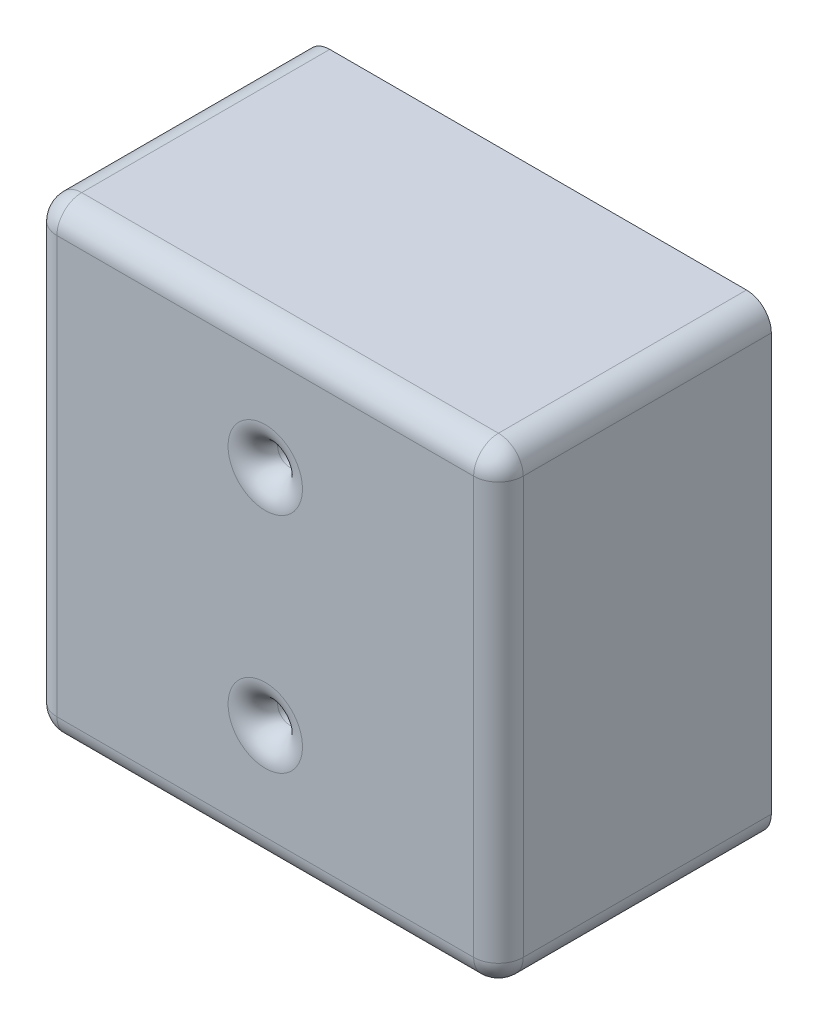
SolidWorks part; units mm, degrees
ref_plane "Plan de face" through (0, 0, 0) normal (0, 0, 1) x (1, 0, 0)
ref_plane "Plan de dessus" through (0, 0, 0) normal (0, 1, 0) x (1, 0, 0)
ref_plane "Plan de droite" through (0, 0, 0) normal (1, 0, 0) x (0, 0, -1)
sketch "Esquisse1" plane through (0, 0, 0) normal (0, 0, 1) x (1, 0, 0)
  line L1 (-42, 47) -> (42, 47)
  line L2 (-47, 42) -> (-47, -42)
  line L3 (-42, -47) -> (42, -47)
  line L4 (47, 42) -> (47, -42)
  arc A0 (-47, 42) -> (-42, 47) centre (-42, 42) cw
  arc A1 (47, 42) -> (42, 47) centre (42, 42) ccw
  arc A2 (42, -47) -> (47, -42) centre (42, -42) ccw
  arc A3 (-47, -42) -> (-42, -47) centre (-42, -42) ccw
  point P6 (-47, 47)
  point P9 (47, 47)
  point P14 (-47, -47)
  dimension "D3" = 5
  dimension "D1" = 94
  dimension "D2" = 94
  dimension "D4" = 47
  dimension "D5" = 47
extrude "Extrusion1" add sketch "Esquisse1" along normal blind 55
sketch "Esquisse2" plane through (0, 0, 0) normal (0, 0, -1) x (-1, 0, 0)
  circle A0 centre (0, 25) radius 3
  circle A1 centre (0, -25) radius 3
  dimension "D3" = 6
  dimension "D1" = 50
  dimension "D2" = 25
extrude "Enlèv. mat.-Extru.1" cut sketch "Esquisse2" against normal blind 20
sketch "Esquisse3" plane through (0, 0, 55) normal (0, 0, 1) x (1, 0, 0)
  circle A0 centre (0, 22.5) radius 2.5
  circle A1 centre (0, -22.5) radius 2.5
  dimension "D3" = 5
  dimension "D1" = 45
  dimension "D2" = 22.5
extrude "Enlèv. mat.-Extru.2" cut sketch "Esquisse3" against normal blind 20
fillet "Congé1" radius 5 10 edges at (0, 47, 55) (45.5355, 45.5355, 55) (47, 0, 55) (45.5355, -45.5355, 55) (0, -47, 55) (-45.5355, -45.5355, 55) (-47, 0, 55) (-45.5355, 45.5355, 55) (2.5, 22.5, 55) (2.5, -22.5, 55)
